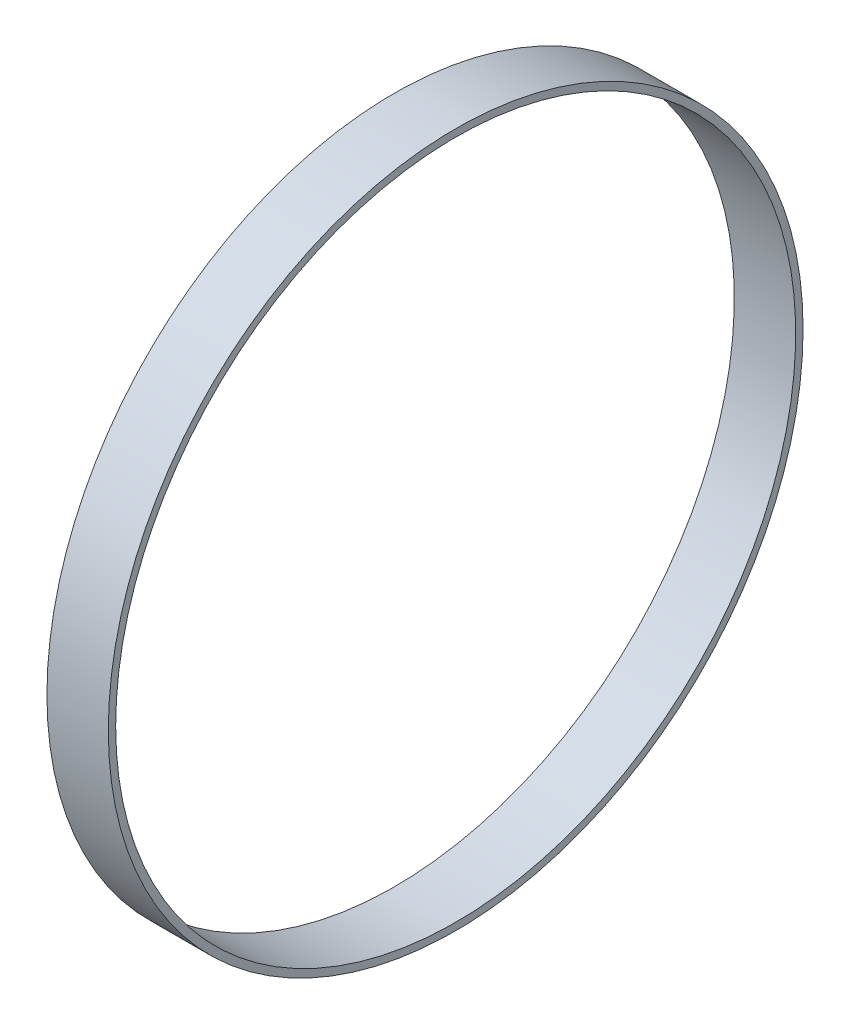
SolidWorks part; units mm, degrees
ref_plane "Plan de face" through (0, 0, 0) normal (0, 0, 1) x (1, 0, 0)
ref_plane "Plan de dessus" through (0, 0, 0) normal (0, 1, 0) x (1, 0, 0)
ref_plane "Plan de droite" through (0, 0, 0) normal (1, 0, 0) x (0, 0, -1)
sketch "Esquisse1" plane through (0, 0, 0) normal (0, 0, 1) x (1, 0, 0)
  line L0 (0, 0) -> (15.845, 0) construction
  line L1 (-2.5, 28.3) -> (2.5, 28.3)
  line L2 (-2.5, 28.3) -> (-2.5, 27.7)
  line L3 (-2.5, 27.7) -> (2.5, 27.7)
  line L4 (2.5, 28.3) -> (2.5, 27.7)
  dimension "D1" = 5
  dimension "D2" = 0.6
  dimension "D3" = 2.5
  dimension "D4" = 27.7
revolve "Révolution1" add sketch "Esquisse1" angle 360 about L0
